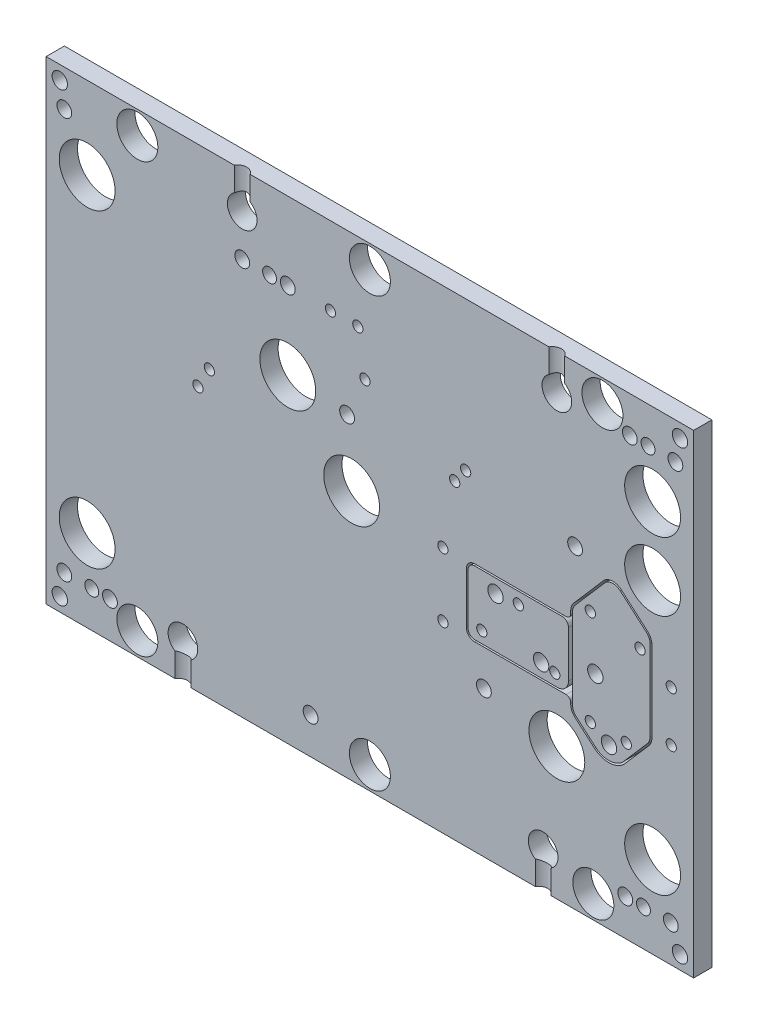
SolidWorks part; units mm, degrees
other "<P250520L_320  Punch Pad Backup>-<Hole13>"
other "<P250520L_315 Perf Holder Backup>-<Hole14>"
ref_plane "Front" through (0, 0, 0) normal (0, 0, 1) x (1, 0, 0)
ref_plane "Top" through (0, 0, 0) normal (0, 1, 0) x (1, 0, 0)
ref_plane "Right" through (0, 0, 0) normal (1, 0, 0) x (0, 0, -1)
sketch "Sketch1" plane through (0, 0, 0) normal (0, 0, 1) x (1, 0, 0)
  line L4 (-1196.34, -180.975) -> (-745.49, -180.975)
  line L5 (-1196.34, 25.4) -> (-1196.34, -180.975)
  line L6 (-745.49, 149.225) -> (-1072.515, 149.225)
  line L7 (-745.49, -180.975) -> (-745.49, 149.225)
  line L8 (-1196.34, -180.975) -> (-745.49, -180.975)
  line L9 (-1196.34, 149.225) -> (-1196.34, -180.975)
  line L10 (-745.49, 149.225) -> (-1196.34, 149.225)
  line L11 (-745.49, -180.975) -> (-745.49, 149.225)
  line L26 (-1072.515, 149.225) -> (-1196.34, 25.4)
  dimension "D1" = 0
extrude "Boss-Extrude1" add sketch "Sketch1" along normal blind 12.7 separate body
sketch "Sketch2-P250520L_315 Perf Holder Backup-1" plane through (0, 0, 0) normal (0, 0, -1) x (-1, 0, 0)
  line L0 (777.7097, -55.7498) -> (794.0493, -74.565)
  line L1 (813.757, -75.9528) -> (827.1944, -64.2834)
  line L2 (829.818, -58.5301) -> (829.818, -2.3863)
  line L3 (827.9513, 2.6101) -> (807.4481, 26.2197)
  line L4 (796.6984, 26.9766) -> (778.4666, 11.1437)
  line L5 (775.843, 5.3903) -> (775.843, -50.7535)
  line L6 (775.843, 5.3903) -> (775.843, -50.7535)
  line L7 (796.6984, 26.9766) -> (778.4666, 11.1437)
  line L8 (827.9513, 2.6101) -> (807.4481, 26.2197)
  line L9 (829.818, -58.5301) -> (829.818, -2.3863)
  line L10 (813.757, -75.9528) -> (827.1944, -64.2834)
  line L11 (777.7097, -55.7498) -> (794.0493, -74.565)
  arc A0 (794.0493, -74.565) -> (813.757, -75.9528) centre (804.5971, -65.405) ccw
  arc A1 (827.1944, -64.2834) -> (829.818, -58.5301) centre (822.198, -58.5301) ccw
  arc A2 (829.818, -2.3863) -> (827.9513, 2.6101) centre (822.198, -2.3863) ccw
  arc A3 (807.4481, 26.2197) -> (796.6984, 26.9766) centre (801.6947, 21.2233) ccw
  arc A4 (778.4666, 11.1437) -> (775.843, 5.3903) centre (783.463, 5.3903) ccw
  arc A5 (775.843, -50.7535) -> (777.7097, -55.7498) centre (783.463, -50.7535) ccw
  arc A6 (775.843, -50.7535) -> (777.7097, -55.7498) centre (783.463, -50.7535) ccw
  arc A7 (778.4666, 11.1437) -> (775.843, 5.3903) centre (783.463, 5.3903) ccw
  arc A8 (807.4481, 26.2197) -> (796.6984, 26.9766) centre (801.6947, 21.2233) ccw
  arc A9 (829.818, -2.3863) -> (827.9513, 2.6101) centre (822.198, -2.3863) ccw
  arc A10 (827.1944, -64.2834) -> (829.818, -58.5301) centre (822.198, -58.5301) ccw
  arc A11 (794.0493, -74.565) -> (813.757, -75.9528) centre (804.5971, -65.405) ccw
  circle A12 centre (782.828, -1.0017) radius 3.5687
  circle A13 centre (817.425, 4.0783) radius 3.5687
  arc A14 (795.2867, -59.5363) -> (795.2867, -59.5363) centre (791.718, -59.5363) ccw
  arc A15 (820.9937, -62.5967) -> (820.9937, -62.5967) centre (817.425, -62.5967) ccw
  circle A16 centre (813.943, -31.75) radius 3.5687
  circle A17 centre (804.418, -69.8464) radius 3.5687
  circle A28 centre (804.418, -69.8464) radius 3.5687
  circle A29 centre (813.943, -31.75) radius 3.5687
sketch "Sketch3-P250520L_315 Perf Holder Backup-1" plane through (0, 0, 0) normal (0, 0, -1) x (-1, 0, 0)
  line L6 (776.7508, -56.5826) -> (793.0904, -75.3977)
  line L7 (814.5898, -76.9117) -> (828.0271, -65.2423)
  line L8 (831.088, -58.5301) -> (831.088, -2.3863)
  line L9 (828.9102, 3.4428) -> (808.407, 27.0524)
  line L10 (795.8657, 27.9355) -> (777.6339, 12.1025)
  line L11 (774.573, 5.3903) -> (774.573, -50.7535)
  line L12 (776.7508, -56.5826) -> (793.0904, -75.3977)
  line L13 (814.5898, -76.9117) -> (828.0271, -65.2423)
  line L14 (831.088, -58.5301) -> (831.088, -2.3863)
  line L15 (828.9102, 3.4428) -> (808.407, 27.0524)
  line L16 (795.8657, 27.9355) -> (777.6339, 12.1025)
  line L17 (774.573, 5.3903) -> (774.573, -50.7535)
  arc A6 (793.0904, -75.3977) -> (814.5898, -76.9117) centre (804.5971, -65.405) ccw
  arc A7 (828.0271, -65.2423) -> (831.088, -58.5301) centre (822.198, -58.5301) ccw
  arc A8 (831.088, -2.3863) -> (828.9102, 3.4428) centre (822.198, -2.3863) ccw
  arc A9 (808.407, 27.0524) -> (795.8657, 27.9355) centre (801.6947, 21.2233) ccw
  arc A10 (777.6339, 12.1025) -> (774.573, 5.3903) centre (783.463, 5.3903) ccw
  arc A11 (774.573, -50.7535) -> (776.7508, -56.5826) centre (783.463, -50.7535) ccw
  arc A12 (793.0904, -75.3977) -> (814.5898, -76.9117) centre (804.5971, -65.405) ccw
  arc A13 (828.0271, -65.2423) -> (831.088, -58.5301) centre (822.198, -58.5301) ccw
  arc A14 (831.088, -2.3863) -> (828.9102, 3.4428) centre (822.198, -2.3863) ccw
  arc A15 (808.407, 27.0524) -> (795.8657, 27.9355) centre (801.6947, 21.2233) ccw
  arc A16 (777.6339, 12.1025) -> (774.573, 5.3903) centre (783.463, 5.3903) ccw
  arc A17 (774.573, -50.7535) -> (776.7508, -56.5826) centre (783.463, -50.7535) ccw
extrude "Cut-Extrude1" cut sketch "Sketch3-P250520L_315 Perf Holder Backup-1" against normal through all
sketch "Sketch2-P250520L_320  Punch Pad Backup-1" plane through (0, 0, 0) normal (0, 0, -1) x (-1, 0, 0)
  line L0 (840.2633, -53.1754) -> (898.0483, -53.1754)
  line L1 (902.4933, -48.7304) -> (902.4933, -13.1704)
  line L2 (898.0483, -8.7254) -> (837.0883, -8.7254)
  line L3 (832.6433, -13.1704) -> (832.6433, -45.5554)
  line L4 (832.6433, -13.1704) -> (832.6433, -45.5554)
  line L5 (898.0483, -8.7254) -> (837.0883, -8.7254)
  line L6 (902.4933, -48.7304) -> (902.4933, -13.1704)
  line L7 (840.2633, -53.1754) -> (898.0483, -53.1754)
  arc A0 (898.0483, -53.1754) -> (902.4933, -48.7304) centre (898.0483, -48.7304) ccw
  arc A1 (902.4933, -13.1704) -> (898.0483, -8.7254) centre (898.0483, -13.1704) ccw
  arc A2 (837.0883, -8.7254) -> (832.6433, -13.1704) centre (837.0883, -13.1704) ccw
  arc A3 (832.6433, -45.5554) -> (840.2633, -53.1754) centre (840.2633, -45.5554) ccw
  arc A4 (832.6433, -45.5554) -> (840.2633, -53.1754) centre (840.2633, -45.5554) ccw
  arc A5 (837.0883, -8.7254) -> (832.6433, -13.1704) centre (837.0883, -13.1704) ccw
  arc A6 (902.4933, -13.1704) -> (898.0483, -8.7254) centre (898.0483, -13.1704) ccw
  arc A7 (898.0483, -53.1754) -> (902.4933, -48.7304) centre (898.0483, -48.7304) ccw
  circle A8 centre (842.1683, -45.2379) radius 3.5687
  circle A9 centre (892.9683, -45.2379) radius 3.5687
  circle A10 centre (867.5683, -16.6629) radius 3.5687
  circle A11 centre (851.6933, -43.6504) radius 3.5687
  circle A12 centre (883.4433, -18.2504) radius 3.5687
  circle A15 centre (867.5683, -16.6629) radius 3.5687
  circle A16 centre (892.9683, -45.2379) radius 3.5687
  circle A17 centre (842.1683, -45.2379) radius 3.5687
  circle A23 centre (883.4433, -18.2504) radius 3.5687
  circle A24 centre (851.6933, -43.6504) radius 3.5687
sketch "Sketch3-P250520L_320  Punch Pad Backup-1" plane through (0, 0, 0) normal (0, 0, -1) x (-1, 0, 0)
  line L4 (840.2633, -54.4454) -> (898.0483, -54.4454)
  line L5 (903.7633, -48.7304) -> (903.7633, -13.1704)
  line L6 (898.0483, -7.4554) -> (837.0883, -7.4554)
  line L7 (831.3733, -13.1704) -> (831.3733, -45.5554)
  line L8 (840.2633, -54.4454) -> (898.0483, -54.4454)
  line L9 (903.7633, -48.7304) -> (903.7633, -13.1704)
  line L10 (898.0483, -7.4554) -> (837.0883, -7.4554)
  line L11 (831.3733, -13.1704) -> (831.3733, -45.5554)
  arc A4 (898.0483, -54.4454) -> (903.7633, -48.7304) centre (898.0483, -48.7304) ccw
  arc A5 (903.7633, -13.1704) -> (898.0483, -7.4554) centre (898.0483, -13.1704) ccw
  arc A6 (837.0883, -7.4554) -> (831.3733, -13.1704) centre (837.0883, -13.1704) ccw
  arc A7 (831.3733, -45.5554) -> (840.2633, -54.4454) centre (840.2633, -45.5554) ccw
  arc A8 (898.0483, -54.4454) -> (903.7633, -48.7304) centre (898.0483, -48.7304) ccw
  arc A9 (903.7633, -13.1704) -> (898.0483, -7.4554) centre (898.0483, -13.1704) ccw
  arc A10 (837.0883, -7.4554) -> (831.3733, -13.1704) centre (837.0883, -13.1704) ccw
  arc A11 (831.3733, -45.5554) -> (840.2633, -54.4454) centre (840.2633, -45.5554) ccw
extrude "Cut-Extrude2" cut sketch "Sketch3-P250520L_320  Punch Pad Backup-1" against normal through all
hole_wizard "Hole1" positions "Point_Sketch" profile "Profil_Sketch" hole size "Ø0.15" standard "ISO"
sketch "Point_Sketch" plane through (-757.4245, -6.0618, 0) normal (0, 0, 1) x (-1, 0, 0)
  point P0 (3.6543, 7.4261)
  point P2 (3.6543, 42.3511)
sketch "Profil_Sketch" plane through (-761.0788, -13.4879, 0) normal (1, 0, 0) x (0, 1, 0)
  line L0 (0, 0) -> (0, 12.7)
  line L1 (0, 12.7) -> (3.5687, 12.7)
  line L2 (3.5687, 12.7) -> (3.5687, 0)
  line L5 (3.5687, 0) -> (0, 0)
  line L11 (0, -6.35) -> (0, 107.95) construction
  dimension "Diameter" = 7.1374
  dimension "Thru Hole Depth" = 12.7
other "usin_DL090_.25-20x1.75-SHCS<1>"
hole_wizard "Hole11" positions "Point_Sketch1" profile "Profil_Sketch1" hole size "Ø0.15" standard "ISO"
sketch "Point_Sketch1" plane through (-916.4285, 1.8757, 0) normal (0, 0, 1) x (-1, 0, 0)
  point P0 (3.6543, 10.6011)
  point P2 (3.6543, 55.0511)
sketch "Profil_Sketch1" plane through (-920.0828, -8.7254, 0) normal (1, 0, 0) x (0, 1, 0)
  line L0 (0, 0) -> (0, 12.7)
  line L1 (0, 12.7) -> (3.5687, 12.7)
  line L2 (3.5687, 12.7) -> (3.5687, 0)
  line L5 (3.5687, 0) -> (0, 0)
  line L11 (0, -6.35) -> (0, 107.95) construction
  dimension "Diameter" = 7.1374
  dimension "Thru Hole Depth" = 12.7
other "usin_DL090_.25-20x1.75-SHCS<2>"
hole_wizard "Hole12" positions "Point_Sketch2" profile "Profil_Sketch2" hole size "Ø0.15" standard "ISO"
sketch "Point_Sketch2" plane through (-900.5857, 56.3211, 0) normal (0, 0, 1) x (-1, 0, 0)
  point P0 (3.6543, 10.6011)
  point P2 (11.2743, 20.7611)
sketch "Profil_Sketch2" plane through (-904.24, 45.72, 0) normal (1, 0, 0) x (0, 1, 0)
  line L0 (0, 0) -> (0, 12.7)
  line L1 (0, 12.7) -> (3.5687, 12.7)
  line L2 (3.5687, 12.7) -> (3.5687, 0)
  line L5 (3.5687, 0) -> (0, 0)
  line L11 (0, -6.35) -> (0, 107.95) construction
  dimension "Diameter" = 7.1374
  dimension "Thru Hole Depth" = 12.7
other "usin_DL090_.25-20x3-SHCS<3>"
hole_wizard "Hole13" positions "Point_Sketch3" profile "Profil_Sketch3" hole size "Ø0.15" standard "ISO"
sketch "Point_Sketch3" plane through (-970.6897, 76.1331, 0) normal (0, 0, 1) x (-1, 0, 0)
  point P0 (3.6543, 10.6011)
  point P2 (8.6073, -18.8629)
  point P4 (27.6573, -18.8629)
sketch "Profil_Sketch3" plane through (-974.344, 65.532, 0) normal (1, 0, 0) x (0, 1, 0)
  line L0 (0, 0) -> (0, 12.7)
  line L1 (0, 12.7) -> (3.5687, 12.7)
  line L2 (3.5687, 12.7) -> (3.5687, 0)
  line L5 (3.5687, 0) -> (0, 0)
  line L11 (0, -6.35) -> (0, 107.95) construction
  dimension "Diameter" = 7.1374
  dimension "Thru Hole Depth" = 12.7
other "usin_DL090_.25-20x3-SHCS<4>"
hole_wizard "Hole14" positions "Point_Sketch4" profile "Profil_Sketch4" hole size "Ø0.15" standard "ISO"
sketch "Point_Sketch4" plane through (-1077.4967, 28.0636, 0) normal (0, 0, 1) x (-1, 0, 0)
  point P0 (5.1783, 10.6011)
  point P2 (13.1158, 24.8886)
sketch "Profil_Sketch4" plane through (-1082.675, 17.4625, 0) normal (1, 0, 0) x (0, 1, 0)
  line L0 (0, 0) -> (0, 12.7)
  line L1 (0, 12.7) -> (3.5687, 12.7)
  line L2 (3.5687, 12.7) -> (3.5687, 0)
  line L5 (3.5687, 0) -> (0, 0)
  line L11 (0, -6.35) -> (0, 107.95) construction
  dimension "Diameter" = 7.1374
  dimension "Thru Hole Depth" = 12.7
other "usin_DL090_.25-20x3-SHCS<5>"
hole_wizard "Hole15" positions "Point_Sketch5" profile "Profil_Sketch5" hole size "Ø0.15" standard "ISO"
sketch "Point_Sketch5" plane through (-777.7193, 55.0511, 12.7) normal (0, 0, -1) x (1, 0, 0)
  point P0 (3.6543, 10.6011)
  point P2 (-63.0207, 143.9511)
  point P4 (3.6543, -37.0239)
  point P6 (3.6543, 178.8761)
  point P8 (-390.0457, 178.8761)
  point P10 (-390.0457, -37.0239)
  point P12 (-250.3457, 13.7761)
  point P14 (-205.8957, 61.4011)
sketch "Profil_Sketch5" plane through (-774.065, 44.45, 12.7) normal (1, 0, 0) x (0, -1, 0)
  line L0 (0, 0) -> (0, 12.7)
  line L1 (0, 12.7) -> (19.4437, 12.7)
  line L2 (19.4437, 12.7) -> (19.4437, 0)
  line L5 (19.4437, 0) -> (0, 0)
  line L11 (0, -6.35) -> (0, 107.95) construction
  dimension "Diameter" = 38.8874
  dimension "Thru Hole Depth" = 12.7
other "usin_DL090_DADCO INCH U 0600.025 - 1500 psi<6>"
hole_wizard "Hole16" positions "Point_Sketch6" profile "Profil_Sketch6" hole size "Ø0.15" standard "ISO"
sketch "Point_Sketch6" plane through (-805.3357, -154.4989, 0) normal (0, 0, 1) x (-1, 0, 0)
  point P0 (10.0043, 10.6011)
  point P2 (3.6543, -287.8489)
  point P4 (327.5043, -287.8489)
  point P6 (327.5043, 10.6011)
  point P8 (165.5793, 10.6011)
  point P10 (165.5793, -287.8489)
sketch "Profil_Sketch6" plane through (-815.34, -165.1, 0) normal (1, 0, 0) x (0, 1, 0)
  line L0 (0, 0) -> (0, 12.7)
  line L1 (0, 12.7) -> (14.2875, 12.7)
  line L2 (14.2875, 12.7) -> (14.2875, 0)
  line L5 (14.2875, 0) -> (0, 0)
  line L11 (0, -6.35) -> (0, 107.95) construction
  dimension "Diameter" = 28.575
  dimension "Thru Hole Depth" = 12.7
other "usin_DL090<7>"
hole_wizard "Hole17" positions "Point_Sketch7" profile "Profil_Sketch7" hole size "Ø0.15" standard "ISO"
sketch "Point_Sketch7" plane through (-1056.1607, 134.4261, 0) normal (0, 0, 1) x (-1, 0, 0)
  point P0 (3.6543, 39.1761)
  point P2 (-297.9707, 10.6011)
  point P4 (-294.7957, 290.0011)
  point P6 (127.4793, 290.0011)
  point P8 (-69.3707, 96.3261)
  point P10 (-164.6207, 213.8011)
  point P12 (127.4793, 10.6011)
  point P14 (-43.9707, 290.0011)
  point P16 (-228.1207, 96.3261)
sketch "Profil_Sketch7" plane through (-1059.815, 95.25, 0) normal (1, 0, 0) x (0, 1, 0)
  line L0 (0, 0) -> (0, 12.7)
  line L1 (0, 12.7) -> (5.1562, 12.7)
  line L2 (5.1562, 12.7) -> (5.1562, 0)
  line L5 (5.1562, 0) -> (0, 0)
  line L11 (0, -6.35) -> (0, 107.95) construction
  dimension "Diameter" = 10.3124
  dimension "Thru Hole Depth" = 12.7
other "usin_DL090_.375-16x2-SHCS<8>"
hole_wizard "Hole18" positions "Point_Sketch8" profile "Profil_Sketch8" hole size "Ø0.15" standard "ISO"
sketch "Point_Sketch8" plane through (-1044.4193, 134.4261, 12.7) normal (0, 0, -1) x (1, 0, 0)
  point P0 (3.6543, 39.1761)
  point P2 (-120.1707, 290.0011)
  point P4 (264.0043, 290.0011)
  point P6 (267.1793, 10.6011)
sketch "Profil_Sketch8" plane through (-1040.765, 95.25, 12.7) normal (1, 0, 0) x (0, -1, 0)
  line L0 (0, 0) -> (0, 12.7)
  line L1 (0, 12.7) -> (4.826, 12.7)
  line L2 (4.826, 12.7) -> (4.826, 0)
  line L5 (4.826, 0) -> (0, 0)
  line L11 (0, -6.35) -> (0, 107.95) construction
  dimension "Diameter" = 9.652
  dimension "Thru Hole Depth" = 12.7
other "usin_DL090_.375 x 2.00 DOWEL PIN<9>"
hole_wizard "Hole19" positions "Point_Sketch9" profile "Profil_Sketch9" counterbore size "1/4" standard "ANSI Inch"
sketch "Point_Sketch9" plane through (-1199.6841, 140.635, 12.7) normal (0, 0, -1) x (1, 0, 0)
  point P0 (12.8691, 0.935)
  point P2 (12.8691, 312.085)
  point P4 (444.6691, 312.085)
  point P6 (444.6691, 0.935)
sketch "Profil_Sketch9" plane through (-1186.815, 139.7, 12.7) normal (1, 0, 0) x (0, -1, 0)
  line L0 (0, 0) -> (0, 12.7)
  line L1 (0, 12.7) -> (3.5687, 12.7)
  line L3 (3.5687, 12.7) -> (3.5687, 7.874)
  line L4 (3.5687, 7.874) -> (5.3594, 7.874)
  line L5 (5.3594, 7.874) -> (5.3594, 0)
  line L7 (5.3594, 0) -> (0, 0)
  line L11 (0, -6.35) -> (0, 107.95) construction
  dimension "Diameter" = 7.1374
  dimension "Thru Hole Depth" = 12.7
  dimension "L1" = 7.874
other "usin_LS160_.25-20x.625-SHCS<1>"
hole_wizard "Hole110" positions "Point_Sketch10" profile "Profil_Sketch10" hole size "Ø0.15" standard "ISO"
sketch "Point_Sketch10" plane through (-844.3943, -144.9739, 12.7) normal (0, 0, -1) x (1, 0, 0)
  point P0 (-5.8707, 10.6011)
  point P2 (-256.6957, 10.6011)
  point P4 (-215.4207, -268.7989)
  point P6 (3.6543, -268.7989)
sketch "Profil_Sketch10" plane through (-850.265, -155.575, 12.7) normal (1, 0, 0) x (0, -1, 0)
  line L0 (0, 0) -> (0, 12.7)
  line L1 (0, 12.7) -> (10.3187, 12.7)
  line L2 (10.3187, 12.7) -> (10.3187, 0)
  line L5 (10.3187, 0) -> (0, 0)
  line L11 (0, -6.35) -> (0, 107.95) construction
  dimension "Diameter" = 20.6375
  dimension "Thru Hole Depth" = 12.7
other "usin_DL090<10>"
hole_wizard "Hole111" positions "Point_Sketch11" profile "Profil_Sketch11" hole size "Ø0.15" standard "ISO"
sketch "Point_Sketch11" plane through (-1024.4107, 105.8511, 0) normal (0, 0, 1) x (-1, 0, 0)
  point P0 (3.6543, 10.6011)
  point P2 (-234.4707, -17.9739)
  point P4 (-231.2957, 261.4261)
  point P6 (127.4793, 261.4261)
sketch "Profil_Sketch11" plane through (-1028.065, 95.25, 0) normal (1, 0, 0) x (0, 1, 0)
  line L0 (0, 0) -> (0, 12.7)
  line L1 (0, 12.7) -> (5.1594, 12.7)
  line L2 (5.1594, 12.7) -> (5.1594, 0)
  line L5 (5.1594, 0) -> (0, 0)
  line L11 (0, -6.35) -> (0, 107.95) construction
  dimension "Diameter" = 10.3187
  dimension "Thru Hole Depth" = 12.7
other "usin_DL090<11>"
sketch "Sketch4" plane through (0, -180.975, 0) normal (0, -1, 0) x (1, 0, 0)
  line L0 (-1196.34, 12.7) -> (-745.49, 12.7) construction
  line L1 (-1101.09, 0) -> (-1101.09, 12.7) construction
  line L2 (-850.265, 0) -> (-850.265, 12.7) construction
  circle A0 centre (-1101.09, 15.875) radius 6.35
  circle A1 centre (-850.265, 15.875) radius 6.35
  dimension "D2" = 12.7
  dimension "D1" = 3.175
extrude "Cut-Extrude3" cut sketch "Sketch4" against normal up to next
sketch "Sketch5" plane through (0, 149.225, 0) normal (0, 1, 0) x (1, 0, 0)
  line L1 (-745.49, -12.7) -> (-1196.34, -12.7) construction
  line L2 (-840.74, 0) -> (-840.74, -12.7) construction
  line L3 (-1059.815, 0) -> (-1059.815, -12.7) construction
  circle A0 centre (-1059.815, -15.875) radius 6.35
  circle A1 centre (-840.74, -15.875) radius 6.35
  dimension "D2" = 12.7
  dimension "D1" = 3.175
extrude "Cut-Extrude4" cut sketch "Sketch5" against normal up to next
sketch "Sketch6" plane through (0, 0, 12.7) normal (0, 0, 1) x (1, 0, 0)
  line L0 (-840.2633, -54.4454) -> (-898.0483, -54.4454) construction
  line L2 (-898.0483, -7.4554) -> (-837.0883, -7.4554) construction
  line L3 (-831.3733, -13.1704) -> (-831.3733, -45.5554) construction
  line L4 (-831.088, -54.4454) -> (-840.2633, -54.4454)
  line L6 (-837.0883, -7.4554) -> (-831.088, -7.4554)
  line L7 (-831.3733, -13.1704) -> (-831.3733, -45.5554)
  line L13 (-831.088, -58.5301) -> (-831.088, -2.3863) construction
  line L19 (-831.088, -54.4454) -> (-831.088, -7.4554)
  arc A2 (-831.3733, -13.1704) -> (-837.0883, -7.4554) centre (-837.0883, -13.1704) ccw construction
  arc A3 (-840.2633, -54.4454) -> (-831.3733, -45.5554) centre (-840.2633, -45.5554) ccw construction
  arc A6 (-831.3733, -13.1704) -> (-837.0883, -7.4554) centre (-837.0883, -13.1704) ccw
  arc A7 (-840.2633, -54.4454) -> (-831.3733, -45.5554) centre (-840.2633, -45.5554) ccw
extrude "Cut-Extrude5" cut sketch "Sketch6" against normal through all
fillet "Fillet1" radius 3.175 2 edges at (-831.088, -54.4454, 6.35) (-831.088, -7.4554, 6.35)
sketch "Sketch1 _Machining axis" plane through (0, 0, 12.7) normal (0, 0, 1) x (1, 0, 0)
  line L0 (-898.6833, -30.9504) -> (-903.7633, -30.9504) construction
  line L1 (-903.7633, -48.7304) -> (-903.7633, -13.1704) construction
  point P0 (-898.6833, -30.9504)
sketch "Sketch1 _Wire EDM" plane through (0, 0, 12.7) normal (0, 0, 1) x (1, 0, 0)
  circle A0 centre (-898.6833, -30.9504) radius 1.5875
inserted part "24051_315 Perf Holder Backup1" parameters "D1"=0, "D2"=0, "D3"=71.9582
move or copy body "Body-Move/Copy2"
inserted part "24051_320  Punch Pad Backup1" parameters "D1"=0, "D2"=0, "D3"=71.9582
move or copy body "Body-Move/Copy4"
